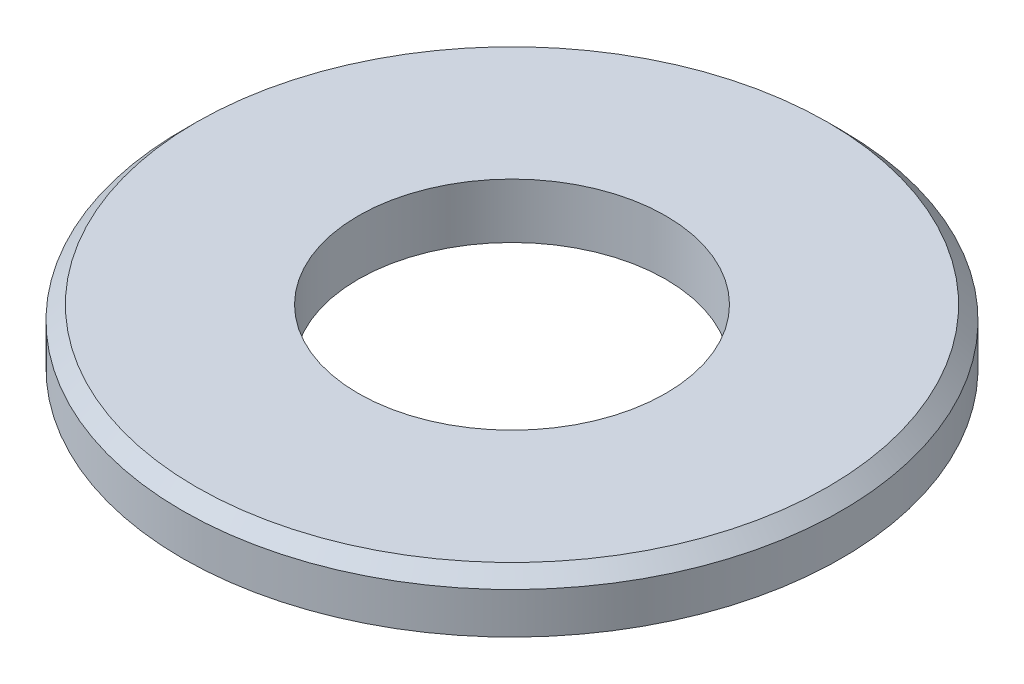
SolidWorks part; units mm, degrees
ref_plane "Face" through (0, 0, 0) normal (0, 0, 1) x (1, 0, 0)
ref_plane "Dessus" through (0, 0, 0) normal (0, 1, 0) x (1, 0, 0)
ref_plane "Droite" through (0, 0, 0) normal (1, 0, 0) x (0, 0, -1)
sketch "Esquisse1" plane through (0, 0, 0) normal (0, 1, 0) x (1, 0, 0)
  circle A0 centre (0, 0) radius 9
  circle A1 centre (0, 0) radius 4.2
  dimension "D2" = 18
  dimension "d1" = 8.4
extrude "Base-Extrusion" add sketch "Esquisse1" along normal blind 1.5
chamfer "Chanfrein3" distance 0.375 angle 45 1 edges at (0, 1.5, 9)
equation "\"D1@Chanfrein3\" = \"e@Base-Extrusion\"/4"
